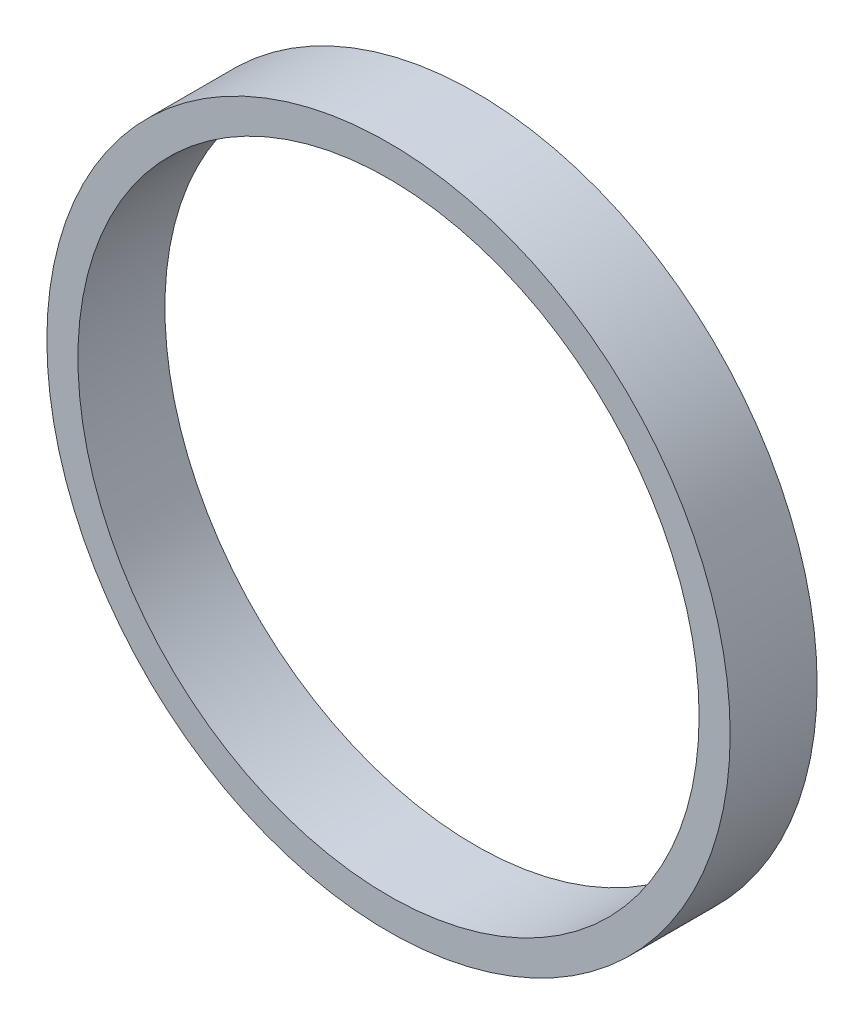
SolidWorks part; units mm, degrees
ref_plane "Спереди" through (0, 0, 0) normal (0, 0, 1) x (1, 0, 0)
ref_plane "Сверху" through (0, 0, 0) normal (0, 1, 0) x (1, 0, 0)
ref_plane "Справа" through (0, 0, 0) normal (1, 0, 0) x (0, 0, -1)
sketch "Sketch1" plane through (0, 0, 0) normal (0, 0, 1) x (1, 0, 0)
  circle A0 centre (0, 0) radius 55
  circle A1 centre (0, 0) radius 50
  dimension "D1" = 110
  dimension "D2" = 5
extrude "Extrude1" add sketch "Sketch1" along normal blind 14
